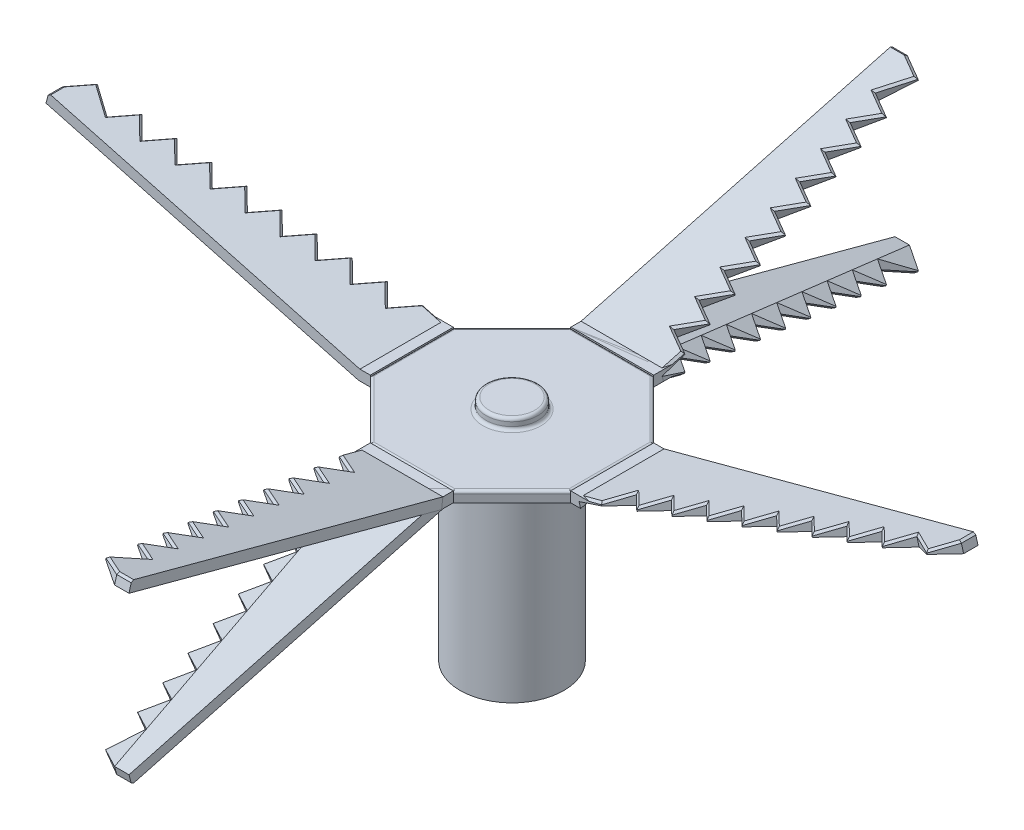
SolidWorks part; units mm, degrees
ref_plane "Front Plane" through (0, 0, 0) normal (0, 0, 1) x (1, 0, 0)
ref_plane "Top Plane" through (0, 0, 0) normal (0, 1, 0) x (1, 0, 0)
ref_plane "Right Plane" through (0, 0, 0) normal (1, 0, 0) x (0, 0, -1)
sketch "Sketch1" plane through (0, 0, 0) normal (0, 1, 0) x (1, 0, 0)
  circle A0 centre (0, 0) radius 5
  dimension "D1" = 10
extrude "Boss-Extrude1" add sketch "Sketch1" along normal blind 20
sketch "Sketch2" plane through (0, 20, 0) normal (0, 1, 0) x (1, 0, 0)
  line L0 (0, 0) -> (0, 9.6569) construction
  line L1 (9.6569, 4) -> (4, 9.6569)
  line L2 (4, 9.6569) -> (-4, 9.6569)
  line L3 (-4, 9.6569) -> (-9.6569, 4)
  line L4 (-9.6569, 4) -> (-9.6569, -4)
  line L5 (-9.6569, -4) -> (-4, -9.6569)
  line L6 (-4, -9.6569) -> (4, -9.6569)
  line L7 (4, -9.6569) -> (9.6569, -4)
  line L8 (9.6569, -4) -> (9.6569, 4)
  circle A0 centre (0, 0) radius 9.6569 construction
  dimension "D1" = 8
extrude "Boss-Extrude2" add sketch "Sketch2" along normal blind 1
sketch "Sketch3" plane through (0, 0, 0) normal (0, 0, 1) x (1, 0, 0)
  line L0 (9.6569, 21) -> (10.6569, 21)
  line L1 (10.6569, 21) -> (40.6569, 29.0385)
  line L3 (4, 21) -> (9.6569, 21) construction
  dimension "D1" = 1
  dimension "D2" = 165
  dimension "D3" = 30
extrude "Extrude-Thin2" add sketch "Sketch3" along normal mid plane 8 separate body thin contours L0 L1
sketch "Sketch4" plane through (-4.5361, 16.9291, 0) normal (-0.2588, 0.9659, 0) x (0.9659, 0.2588, 0)
  line L0 (17.7289, -4) -> (46.7872, 0.6024) construction
  line L2 (15.7289, -4) -> (46.7872, -4) construction
  line L3 (46.7872, -4) -> (46.7872, 4) construction
  line L4 (17.7289, -4) -> (18.9218, -1.803)
  line L5 (18.9218, -1.803) -> (20.7353, -3.5238)
  line L6 (18.9218, -1.803) -> (50.5408, 3.205) construction
  line L7 (20.7353, -3.5238) -> (21.9282, -1.3268)
  line L8 (21.9282, -1.3268) -> (23.7416, -3.0477)
  line L9 (23.7416, -3.0477) -> (24.9345, -0.8506)
  line L10 (24.9345, -0.8506) -> (26.7479, -2.5715)
  line L11 (26.7479, -2.5715) -> (27.9408, -0.3745)
  line L12 (27.9408, -0.3745) -> (29.7543, -2.0954)
  line L13 (29.7543, -2.0954) -> (30.9472, 0.1017)
  line L14 (30.9472, 0.1017) -> (32.7606, -1.6192)
  line L15 (32.7606, -1.6192) -> (33.9535, 0.5778)
  line L19 (33.9535, 0.5778) -> (35.7669, -1.1431)
  line L20 (35.7669, -1.1431) -> (36.9598, 1.054)
  line L21 (36.9598, 1.054) -> (38.7733, -0.6669)
  line L22 (38.7733, -0.6669) -> (39.9662, 1.5301)
  line L23 (39.9662, 1.5301) -> (41.7796, -0.1907)
  line L24 (41.7796, -0.1907) -> (42.9725, 2.0063)
  line L25 (42.9725, 2.0063) -> (45.5943, 0.4134)
  line L26 (45.5943, 0.4134) -> (46.7872, 2.6105)
  line L27 (17.7289, -4) -> (46.7872, -4)
  line L28 (46.7872, -4) -> (46.7872, 2.6105)
  dimension "D1" = 9
  dimension "D2" = 2
  dimension "D3" = 75
  dimension "D4" = 2.5
  dimension "D5" = 2.5
extrude "Cut-Extrude1" cut sketch "Sketch4" against normal blind 8
ref_plane "Plane2" through (13.741, 0, 0) normal (1, 0, 0) x (0, 0, -1)
sketch "Sketch13" plane through (-4.5361, 16.9291, 0) normal (-0.2588, 0.9659, 0) x (0.9659, 0.2588, 0)
  line L0 (30.9472, 0.1017) -> (33.9535, 0.5778) construction
  line L1 (32.7606, -1.6192) -> (32.4503, 0.3397) construction
ref_plane "Plane3" through (30.6283, 8.2068, -5.0222) normal (0.954, 0.2556, -0.1564) x (-0.1511, -0.0405, -0.9877)
sketch "Sketch14" plane through (30.6283, 8.2068, -5.0222) normal (0.954, 0.2556, -0.1564) x (-0.1511, -0.0405, -0.9877)
  line L0 (-6.7242, 17.2308) -> (-4.7408, 16.5262)
  line L1 (-6.7242, 16.5262) -> (-6.7242, 17.5262) construction
  line L2 (-4.7408, 16.5262) -> (-6.7242, 16.5262) construction
  line L3 (-4.7408, 16.5262) -> (-6.7242, 16.5262)
  line L4 (-6.7242, 16.5262) -> (-6.7242, 17.2308)
extrude "Cut-Extrude3" cut sketch "Sketch14" against normal mid plane 35
chamfer "Chamfer1" distance 0.2 angle 45 21 edges at (40.0807, 28.8841, -1.512) (38.2384, 28.3904, -1.2099) (36.396, 27.8968, -0.9078) (34.944, 27.5077, -0.6697) (33.4921, 27.1187, -0.4316) (32.0401, 26.7296, -0.1935) (30.5882, 26.3406, 0.0445) (29.1363, 25.9515, 0.2826) (27.6843, 25.5625, 0.5207) (26.2324, 25.1734, 0.7588) (24.7804, 24.7844, 0.9969) (23.3285, 24.3953, 1.2349) (21.8765, 24.0063, 1.473) (20.4246, 23.6173, 1.7111) (18.9726, 23.2282, 1.9492) (17.5207, 22.8392, 2.1872) (16.0687, 22.4501, 2.4253) (14.6168, 22.0611, 2.6634) (13.1648, 21.672, 2.9015) (11.6228, 21.2588, 4) (40.6569, 29.0385, -3.3052)
pattern_circular "CirPattern3" count 4 over 360 about axis through (0, 0, 0) along (0, 1, 0)
ref_plane "Plane4" through (0, 20.5, 0) normal (0, 1, 0) x (1, 0, 0)
mirror "Mirror3" about plane through (0, 20.5, 0) normal (0, 1, 0)
sketch "Sketch15" plane through (0, 21, 0) normal (0, 1, 0) x (1, 0, 0)
  circle A0 centre (0, 0) radius 2.5
  dimension "D1" = 5
extrude "Boss-Extrude3" add sketch "Sketch15" along normal blind 1
fillet "Fillet1" radius 0.3 2 edges at (0, 21, 2.5) (0, 22, 2.5)
fillet "Fillet2" radius 0.25 8 edges at (6.8284, 21, 6.8284) (0, 21, 9.6569) (-6.8284, 21, 6.8284) (-9.6569, 21, 0) (-6.8284, 21, -6.8284) (0, 21, -9.6569) (6.8284, 21, -6.8284) (9.6569, 21, 0)
